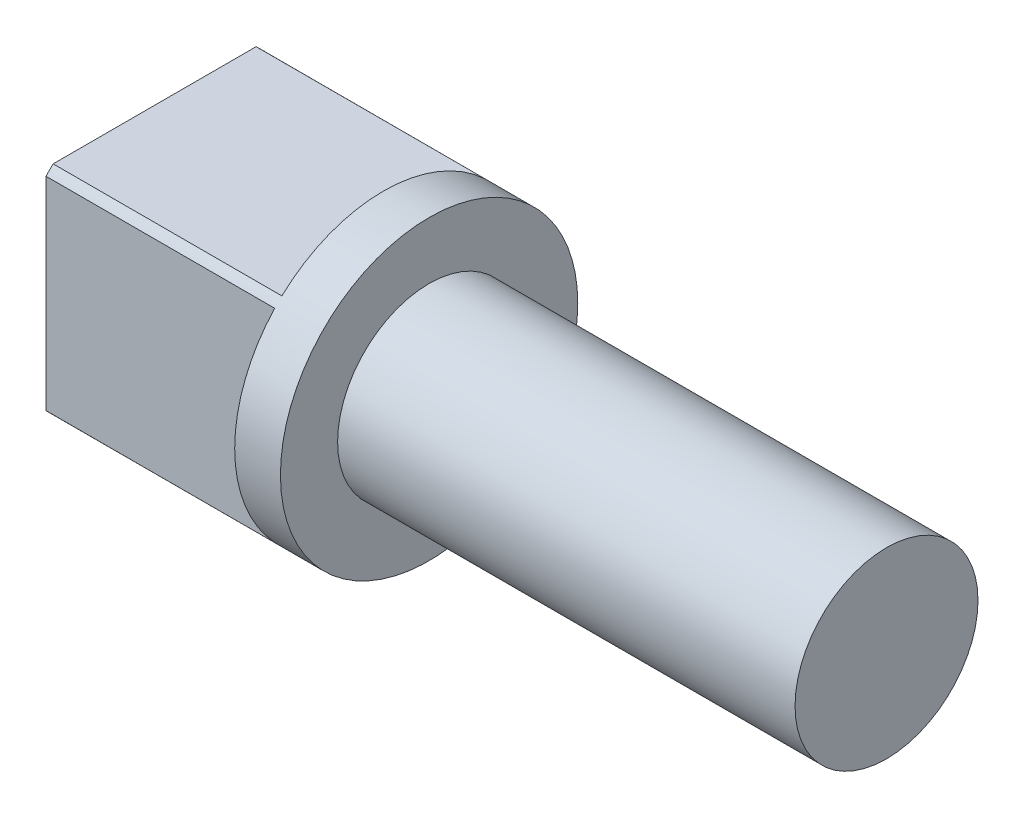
SolidWorks part; units mm, degrees
ref_plane "Front Plane" through (0, 0, 0) normal (0, 0, 1) x (1, 0, 0)
ref_plane "Top Plane" through (0, 0, 0) normal (0, 1, 0) x (1, 0, 0)
ref_plane "Right Plane" through (0, 0, 0) normal (1, 0, 0) x (0, 0, -1)
sketch "Sketch1" plane through (0, 0, 0) normal (1, 0, 0) x (0, 0, -1)
  circle A0 centre (0, 0) radius 6.5
  dimension "D1" = 13
extrude "Boss-Extrude1" add sketch "Sketch1" along normal blind 2
sketch "Sketch2" plane through (2, 0, 0) normal (1, 0, 0) x (0, 0, -1)
  circle A0 centre (0, 0) radius 4
  dimension "D1" = 8
extrude "Boss-Extrude2" add sketch "Sketch2" along normal blind 20
sketch "Sketch3" plane through (0, 0, 0) normal (-1, 0, 0) x (0, 0, 1)
  line L1 (4.4371, -4.75) -> (-4.4371, -4.75)
  line L2 (4.75, -4.4371) -> (4.75, 4.4371)
  line L3 (4.4371, 4.75) -> (-4.4371, 4.75)
  line L4 (-4.75, -4.4371) -> (-4.75, 4.4371)
  line L5 (4.5962, -4.5962) -> (-4.5962, 4.5962) construction
  line L6 (4.5962, 4.5962) -> (-4.5962, -4.5962) construction
  circle A0 centre (0, 0) radius 6.5 construction
  arc A1 (-4.75, -4.4371) -> (-4.4371, -4.75) centre (0, 0) ccw
  arc A2 (-4.4371, 4.75) -> (-4.75, 4.4371) centre (0, 0) ccw
  arc A3 (4.4371, -4.75) -> (4.75, -4.4371) centre (0, 0) ccw
  arc A4 (4.75, 4.4371) -> (4.4371, 4.75) centre (0, 0) ccw
  point P0 (0, 0)
extrude "Boss-Extrude3" add sketch "Sketch3" along normal blind 10
